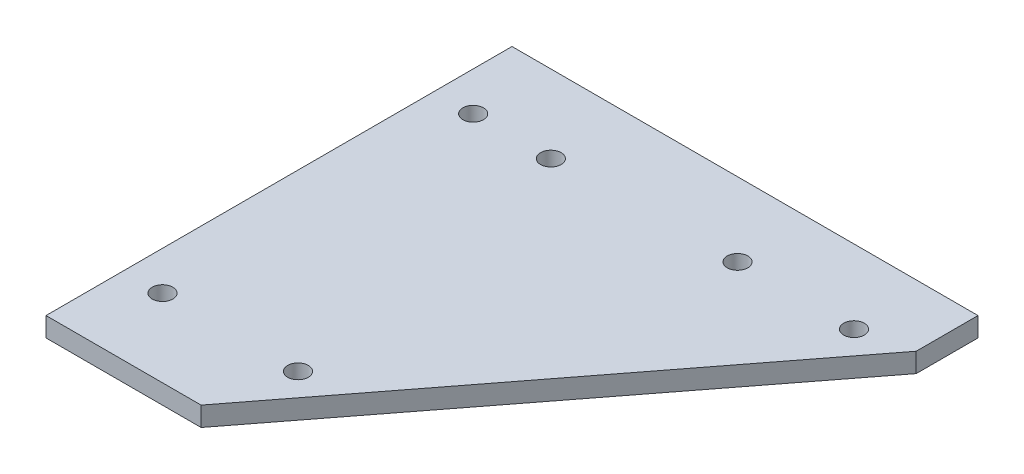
SolidWorks part; units mm, degrees
ref_plane "Front" through (0, 0, 0) normal (0, 0, 1) x (1, 0, 0)
ref_plane "Top" through (0, 0, 0) normal (0, 1, 0) x (1, 0, 0)
ref_plane "Right" through (0, 0, 0) normal (1, 0, 0) x (0, 0, -1)
sketch "Sketch1" plane through (0, 0, 0) normal (0, 1, 0) x (1, 0, 0)
  line L1 (0, 0) -> (152.4, 0)
  line L2 (0, 0) -> (0, 152.4)
  line L3 (0, 152.4) -> (152.4, 152.4)
  line L4 (152.4, 0) -> (152.4, 152.4)
  dimension "D1" = 152.4
  dimension "D2" = 152.4
extrude "Extrude1" add sketch "Sketch1" along normal blind 6.35
sketch "Sketch2" plane through (0, 0, 0) normal (0, -1, 0) x (1, 0, 0)
  line L0 (50.7283, 0) -> (152.4, -132.1891)
  line L1 (0, 0) -> (152.4, 0) construction
  line L2 (152.4, 0) -> (152.4, -152.4) construction
  line L3 (152.4, -132.1891) -> (152.4, 0)
  line L4 (50.7283, 0) -> (152.4, 0)
extrude "Extrude2" cut sketch "Sketch2" against normal through all
sketch "Sketch3" plane through (0, 0, 0) normal (0, -1, 0) x (1, 0, 0)
  circle A0 centre (57.0066, -25.4) radius 3.3731
  circle A1 centre (12.7, -25.4) radius 3.3731
  circle A2 centre (135.9848, -128.2739) radius 3.3731
  circle A3 centre (97.8848, -128.2739) radius 3.3731
  circle A4 centre (38.1, -127) radius 3.3731
  circle A5 centre (12.7, -127) radius 3.3731
extrude "Cut-Extrude1" cut sketch "Sketch3" against normal through all
